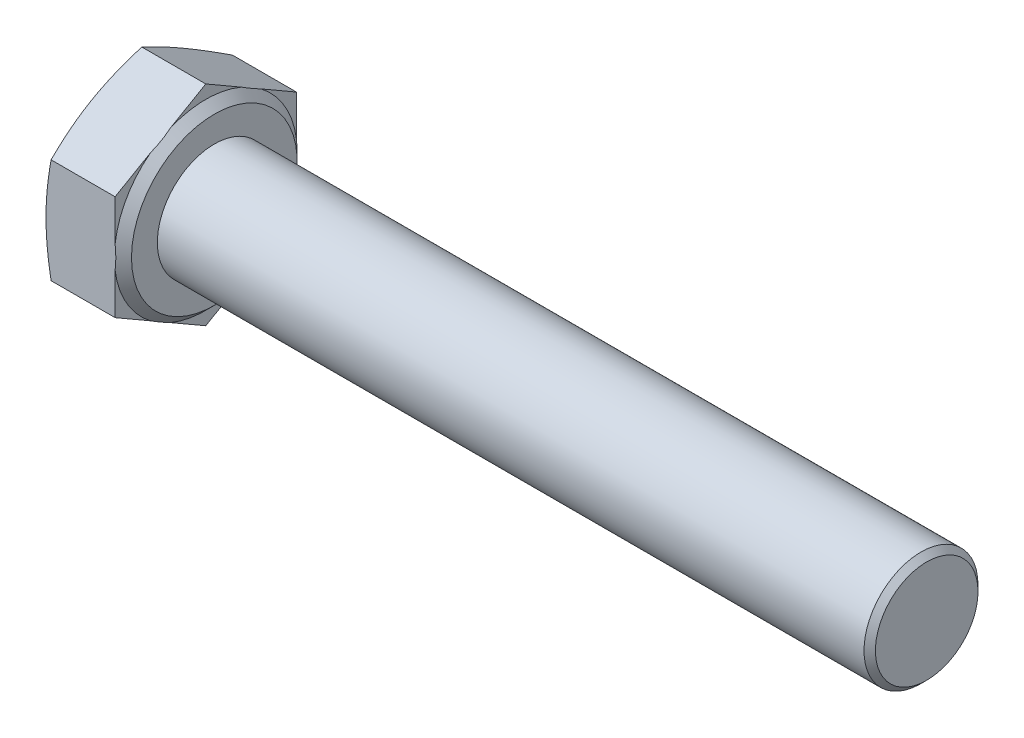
SolidWorks part; units mm, degrees
ref_plane "Front" through (0, 0, 0) normal (0, 0, 1) x (1, 0, 0)
ref_plane "Top" through (0, 0, 0) normal (0, 1, 0) x (1, 0, 0)
ref_plane "Right" through (0, 0, 0) normal (1, 0, 0) x (0, 0, -1)
sketch "Sketch2" plane through (0, 0, 0) normal (1, 0, 0) x (0, 0, -1)
  line L1 (6.365, -3.6748) -> (6.365, 3.6748)
  line L2 (6.365, 3.6748) -> (0, 7.3497)
  line L3 (0, 7.3497) -> (-6.365, 3.6748)
  line L4 (-6.365, 3.6748) -> (-6.365, -3.6748)
  line L5 (-6.365, -3.6748) -> (0, -7.3497)
  line L6 (0, -7.3497) -> (6.365, -3.6748)
  circle A0 centre (0, 0) radius 6.365 construction
  dimension "s" = 12.73
extrude "BaseHead" add sketch "Sketch2" along normal blind 5.45
sketch "Sketch3" plane through (0, 0, 0) normal (0, 0, 1) x (1, 0, 0)
  line L0 (5.45, 7.3497) -> (5.45, 5.815)
  line L2 (5.45, 5.815) -> (4.85, 6.415)
  line L3 (4.85, 6.415) -> (4.85, 7.3497)
  line L5 (4.85, 7.3497) -> (5.45, 7.3497)
  line L6 (-0.9571, 0) -> (7.6478, 0) construction
  line L7 (5.45, 7.3497) -> (0, 7.3497) construction
  dimension "D1" = 45
  dimension "c" = 0.6
  dimension "Dw" = 5.815
revolve "BearingFace" cut sketch "Sketch3" angle 360 about L6
sketch "Sketch4" plane through (0, 0, 0) normal (0, 0, 1) x (1, 0, 0)
  line L0 (-0.4935, 0) -> (3.5626, 0) construction
  line L2 (0, 7.3497) -> (0.3584, 7.3497)
  line L4 (0.3584, 7.3497) -> (0, 6.365)
  line L6 (0, 6.365) -> (0, 7.3497)
  line L7 (4.85, 7.3497) -> (0, 7.3497) construction
  dimension "D1" = 20
  dimension "D2" = 12.73
revolve "HeadChamfer" cut sketch "Sketch4" angle 360 about L0
sketch "Sketch5" plane through (5.45, 0, 0) normal (1, 0, 0) x (0, 0, -1)
  circle A0 centre (0, 0) radius 4
  dimension "d" = 8
extrude "BaseBody" add sketch "Sketch5" along normal blind 50
chamfer "Chamfer1" distance 0.4 angle 45 1 edges at (55.45, 0, -4)
fillet "HeadFillet" [suppressed] radius 0.4
sketch "Sketch6" plane through (0, 0, 0) normal (0, 0, 1) x (1, 0, 0)
  line L0 (5.45, 4.6765) -> (6.1265, 4.6765)
  line L1 (6.1265, 4.6765) -> (6.1265, 4)
  line L2 (6.1265, 4) -> (5.7882, 3.4141)
  line L3 (5.7882, 3.4141) -> (5.45, 4)
  line L4 (5.45, 4) -> (5.45, 4.6765)
  line L5 (55.05, 4) -> (5.45, 4) construction
  line L6 (5.45, -5.815) -> (5.45, 5.815) construction
  dimension "D1" = 0.6765
revolve "Cut-Revolve10" [suppressed] cut sketch "Sketch6" angle 360 about axis through (-0.9571, 0, 0) along (1, 0, 0)
pattern_linear "LPattern10" [suppressed] count 62
equation "\"D2@Sketch4\" = \"s@Sketch2\""
equation "\"D1@Chamfer1\" = 0.05 * \"d@Sketch5\""
equation "\"D1@Sketch6\" =  ( \"d@Sketch5\" - \"D2@ThreadCosmetic1\" )  / 2"
equation "\"pitch@LPattern10\" = \"D1@Sketch6\" * 1.2"
equation "\"D1@LPattern10\" = \"l@BaseBody\" / \"pitch@LPattern10\""
